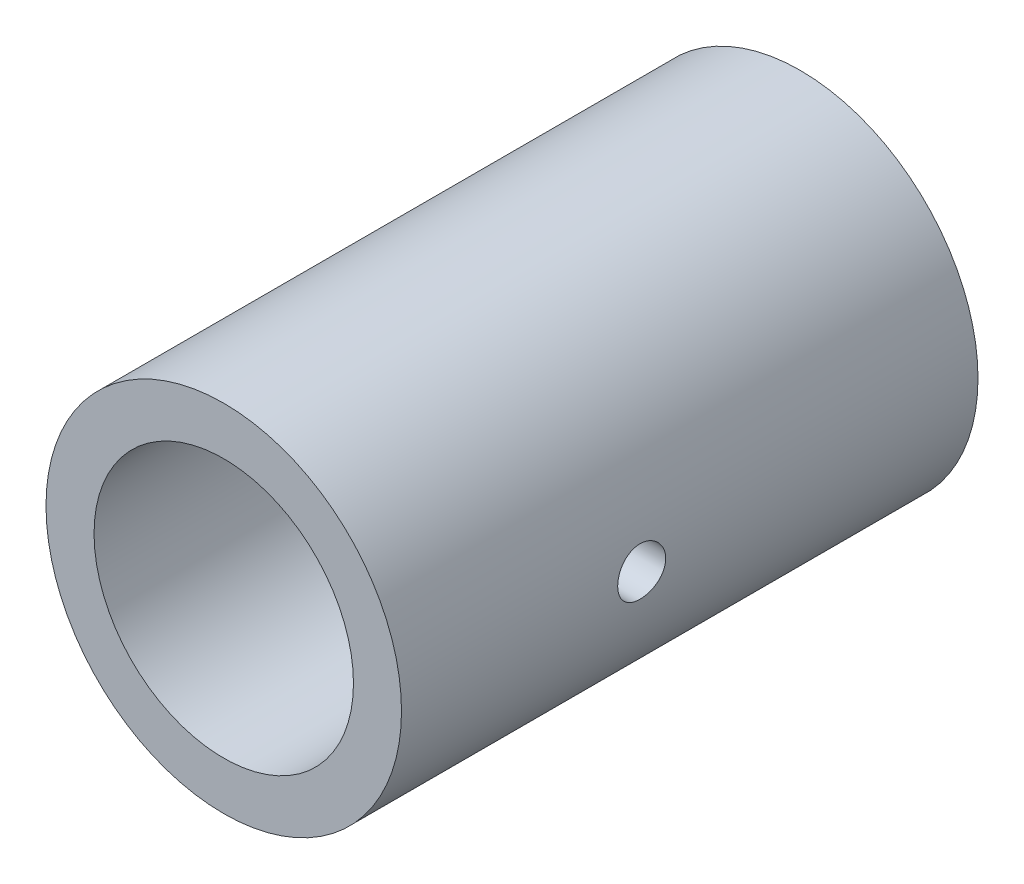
SolidWorks part; units mm, degrees
ref_plane "Front Plane" through (0, 0, 0) normal (0, 0, 1) x (1, 0, 0)
ref_plane "Top Plane" through (0, 0, 0) normal (0, 1, 0) x (1, 0, 0)
ref_plane "Right Plane" through (0, 0, 0) normal (1, 0, 0) x (0, 0, -1)
sketch "Sketch1" plane through (0, 0, 0) normal (0, 0, 1) x (1, 0, 0)
  circle A0 centre (0, 0) radius 100
  dimension "D1" = 200
extrude "Boss-Extrude1" add sketch "Sketch1" along normal blind 5
sketch "Sketch2" plane through (0, 0, 5) normal (0, 0, 1) x (1, 0, 0)
  circle A0 centre (0, 0) radius 12.5 construction
  circle A1 centre (0, 0) radius 18.5
  circle A2 centre (0, 0) radius 13.5
  dimension "D1" = 25
  dimension "D3" = 5
  dimension "D2" = 1
extrude "Boss-Extrude2" add sketch "Sketch2" along normal blind 60
sketch "Sketch3" plane through (0, 0, 5) normal (0, 0, 1) x (1, 0, 0)
  line L0 (81.8475, -88.0396) -> (88.0396, 81.8475) construction
  line L1 (-88.0396, -81.8475) -> (81.8475, -88.0396) construction
  line L2 (-88.0396, -81.8475) -> (-81.8475, 88.0396) construction
  line L3 (-81.8475, 88.0396) -> (88.0396, 81.8475) construction
  line L4 (81.8475, -88.0396) -> (88.0396, 81.8475)
  line L5 (-88.0396, -81.8475) -> (81.8475, -88.0396)
  line L6 (-88.0396, -81.8475) -> (-81.8475, 88.0396)
  line L7 (-81.8475, 88.0396) -> (88.0396, 81.8475)
sketch "Sketch6" plane through (0, -50, 0) normal (0, 1, 0) x (1, 0, 0)
  line L0 (81.8475, -5) -> (88.0396, -5) construction
  line L1 (-12.5, -5) -> (12.5, -5)
  line L2 (-12.5, -5) -> (-12.5, -35)
  line L3 (-12.5, -35) -> (12.5, -35)
  line L4 (12.5, -5) -> (12.5, -35)
  line L5 (0, -2.75) -> (0, 2.75) construction
  point P6 (0, -35)
  dimension "D1" = 25
  dimension "D2" = 30
extrude "Cut-Extrude1" cut sketch "Sketch6" along normal up to next
fillet "Fillet1" radius 10 2 edges at (12.5, -9.3686, 35) (-12.5, -9.3686, 35)
sketch "Sketch7" plane through (0, 0, 0) normal (0, 1, 0) x (1, 0, 0)
  line L0 (-110, 0) -> (110, 0) construction
  line L1 (-100, -5) -> (100, -5)
  line L2 (-100, -5) -> (-100, 0)
  line L3 (-100, 0) -> (100, 0)
  line L4 (100, -5) -> (100, 0)
extrude "Cut-Extrude2" cut sketch "Sketch7" against normal mid plane 260
ref_plane "Plane1" through (18.5, 0, 0) normal (1, 0, 0) x (0, 0, -1)
hole_wizard "M6 Tapped Hole1" positions "Sketch8" profile "Sketch9" tap size "M6" standard "DIN"
sketch "Sketch8" plane through (18.5, 0, 0) normal (1, 0, 0) x (0, 0, -1)
  line L0 (33, 0) -> (-33, 0) construction
  line L1 (-65, 18.5) -> (-65, -18.5) construction
  point P0 (-40, 0)
  dimension "D1" = 25
sketch "Sketch9" plane through (18.5, 0, 40) normal (0, 1, 0) x (0, 0, -1)
  line L0 (0, 0) -> (0, 5)
  line L1 (0, 5) -> (2.5, 5)
  line L2 (2.5, 5) -> (2.5, 0)
  line L5 (2.5, 0) -> (0, 0)
  line L11 (0, -6.35) -> (0, 107.95) construction
  dimension "Thru Tap Drill Dia." = 5
  dimension "Thru Tap Drill Depth" = 5
